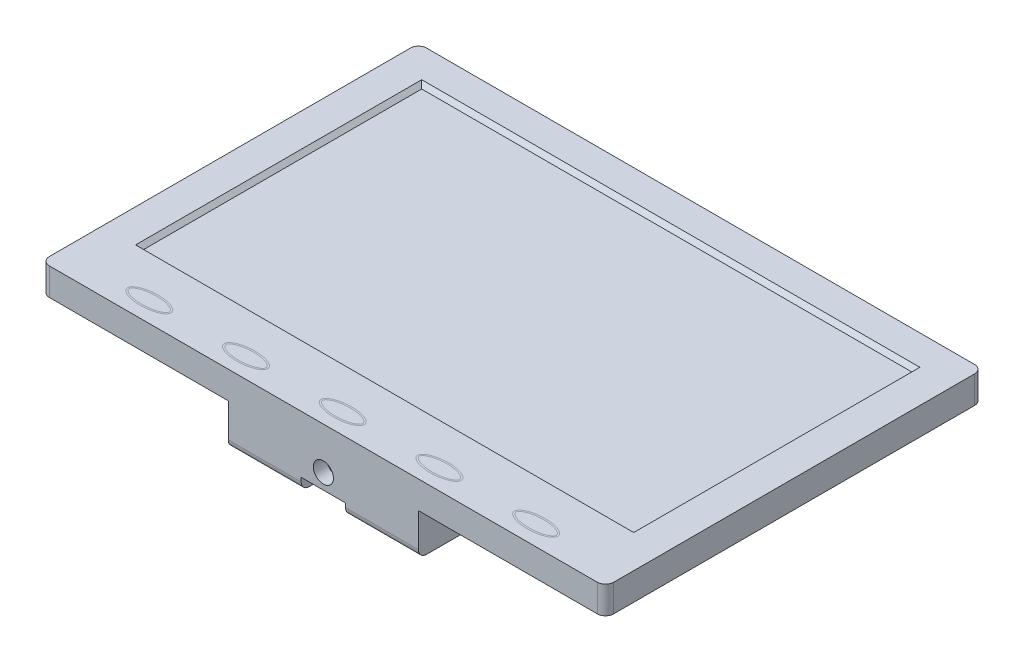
SolidWorks part; units mm, degrees
ref_plane "Front Plane" through (0, 0, 0) normal (0, 0, 1) x (1, 0, 0)
ref_plane "Top Plane" through (0, 0, 0) normal (0, 1, 0) x (1, 0, 0)
ref_plane "Right Plane" through (0, 0, 0) normal (1, 0, 0) x (0, 0, -1)
sketch "Sketch1" plane through (0, 0, 0) normal (0, 1, 0) x (1, 0, 0)
  line L1 (-88.9, 59.436) -> (88.9, 59.436)
  line L2 (-88.9, 59.436) -> (-88.9, -59.436)
  line L3 (-88.9, -59.436) -> (88.9, -59.436)
  line L4 (88.9, 59.436) -> (88.9, -59.436)
  line L5 (-88.9, 59.436) -> (88.9, -59.436) construction
  line L6 (-88.9, -59.436) -> (88.9, 59.436) construction
  point P0 (0, 0)
  dimension "D1" = 118.872
  dimension "D2" = 177.8
extrude "Boss-Extrude1" add sketch "Sketch1" along normal blind 8.636
sketch "Sketch2" plane through (0, 8.636, 0) normal (0, 1, 0) x (1, 0, 0)
  line L0 (-88.9, 59.436) -> (-88.9, -59.436) construction
  line L1 (-77.216, 48.768) -> (77.216, 48.768)
  line L2 (-77.216, 48.768) -> (-77.216, -38.862)
  line L3 (-77.216, -38.862) -> (77.216, -38.862)
  line L4 (77.216, 48.768) -> (77.216, -38.862)
  line L5 (88.9, -59.436) -> (88.9, 59.436) construction
  line L6 (-88.9, -59.436) -> (88.9, -59.436) construction
  line L7 (88.9, 59.436) -> (-88.9, 59.436) construction
  dimension "D1" = 11.684
  dimension "D2" = 11.684
  dimension "D3" = 20.574
  dimension "D4" = 10.668
extrude "Cut-Extrude1" cut sketch "Sketch2" against normal blind 1.27
chamfer "Chamfer1" distance 1.27 angle 45 4 edges at (77.216, 8.636, -4.953) (0, 8.636, 38.862) (-77.216, 8.636, -4.953) (0, 8.636, -48.768)
fillet "Fillet1" radius 2.54 4 edges at (88.9, 4.318, 59.436) (-88.9, 4.318, 59.436) (-88.9, 4.318, -59.436) (88.9, 4.318, -59.436)
sketch "Sketch3" plane through (0, 0, 0) normal (0, -1, 0) x (1, 0, 0)
  line L0 (-29.972, 59.436) -> (-29.972, 49.276)
  line L1 (-86.36, 59.436) -> (86.36, 59.436) construction
  line L2 (-29.972, 49.276) -> (-71.374, 49.276)
  line L3 (-71.374, 49.276) -> (-71.374, -48.26)
  line L4 (-71.374, -48.26) -> (71.374, -48.26)
  line L5 (71.374, -48.26) -> (71.374, 49.276)
  line L6 (71.374, 49.276) -> (29.972, 49.276)
  line L7 (29.972, 49.276) -> (29.972, 59.436)
  line L8 (-29.972, 59.436) -> (29.972, 59.436)
  line L10 (-88.9, -56.896) -> (-88.9, 56.896) construction
  dimension "D1" = 59.944
  dimension "D2" = 97.536
  dimension "D3" = 10.16
  dimension "D4" = 142.748
  dimension "D5" = 58.928
extrude "Boss-Extrude2" add sketch "Sketch3" along normal blind 13.208
sketch "Sketch4" plane through (0, 0, 59.436) normal (0, 0, 1) x (1, 0, 0)
  line L0 (-86.36, 8.636) -> (86.36, 8.636) construction
  line L3 (-29.972, -13.208) -> (-29.972, 0) construction
  circle A0 centre (0, -4.572) radius 3.175
  dimension "D2" = 6.35
  dimension "D1" = 13.208
  dimension "D3" = 29.972
extrude "Cut-Extrude2" cut sketch "Sketch4" against normal blind 4.2672
fillet "Fillet2" radius 2.54 1 edges at (0, -13.208, 59.436)
chamfer "Chamfer2" distance 13.208 angle 30 1 edges at (0, -13.208, -48.26)
chamfer "Chamfer3" distance 13.208 angle 30 2 edges at (71.374, -13.208, 4.3208) (-71.374, -13.208, 4.3208)
chamfer "Chamfer4" distance 13.208 angle 15 2 edges at (46.8602, -13.208, 49.276) (-46.8602, -13.208, 49.276)
fillet "Fillet3" radius 2.54 9 edges at (67.5612, -6.604, 47.5065) (67.5612, -6.604, -44.4472) (-67.5612, -6.604, -44.4472) (63.7484, -13.208, 2.5513) (46.8602, -13.208, 45.7369) (0, -13.208, -40.6344) (-63.7484, -13.208, 2.5513) (-67.5612, -6.604, 47.5065) (-46.8602, -13.208, 45.7369)
sketch "Sketch5" plane through (0, -13.208, 0) normal (0, -1, 0) x (1, 0, 0)
  line L1 (63.5519, 34.4921) -> (88.9519, 34.4921)
  line L2 (63.5519, 34.4921) -> (63.5519, -27.4839)
  line L3 (63.5519, -27.4839) -> (88.9519, -27.4839)
  line L4 (88.9519, 34.4921) -> (88.9519, -27.4839)
  line L5 (-62.2819, -39.1679) -> (62.2819, -39.1679) construction
  line L7 (-63.5519, 34.4921) -> (-88.9519, 34.4921)
  line L8 (-63.5519, 34.4921) -> (-63.5519, -27.4839)
  line L9 (-63.5519, -27.4839) -> (-88.9519, -27.4839)
  line L10 (-88.9519, 34.4921) -> (-88.9519, -27.4839)
  line L11 (62.2819, -39.1679) -> (62.2819, 43.7879) construction
  line L12 (-62.2819, 43.7879) -> (-62.2819, -39.1679) construction
  dimension "D1" = 61.976
  dimension "D2" = 11.684
  dimension "D3" = 25.4
  dimension "D4" = 25.4
  dimension "D5" = 1.27
  dimension "D6" = 1.27
extrude "Cut-Extrude3" cut sketch "Sketch5" against normal up to surface (13.208 mm away)
ref_plane "Plane1" through (0, -8.89, 0) normal (0, 1, 0) x (1, 0, 0)
sketch "Sketch14" plane through (0, -8.89, 0) normal (0, 1, 0) x (1, 0, 0)
  line L0 (-63.5519, 8.4339) -> (-49.5819, 8.4339)
  line L1 (-63.5519, 27.4839) -> (-63.5519, -34.4921) construction
  line L2 (-63.5519, 8.4339) -> (-63.5519, 14.7839)
  line L3 (-63.5519, 14.7839) -> (-49.5819, 14.7839)
  line L4 (-49.5819, 8.4339) -> (-43.2319, 8.4339)
  line L6 (-71.374, 27.4839) -> (-64.4816, 27.4839) construction
  arc A0 (-43.2319, 8.4339) -> (-49.5819, 14.7839) centre (-49.5819, 8.4339) ccw
  dimension "D2" = 13.97
  dimension "D3" = 19.05
  dimension "D1" = 6.35
revolve "Revolve4" add sketch "Sketch14" angle 360 about L0
sketch "Sketch15" plane through (63.5519, 0, 0) normal (1, 0, 0) x (0, 0, -1)
  line L2 (39.1679, -13.208) -> (-43.7879, -13.208) construction
  line L3 (-34.4921, 0) -> (27.4839, 0) construction
  line L4 (27.4839, 0) -> (27.4839, -12.8677) construction
  circle A0 centre (18.5939, -6.604) radius 3.175
  dimension "D1" = 6.35
  dimension "D2" = 6.604
  dimension "D3" = 6.604
  dimension "D4" = 8.89
extrude "Cut-Extrude4" cut sketch "Sketch15" against normal blind 8.89
sketch "Sketch16" plane through (54.6619, 0, 0) normal (1, 0, 0) x (0, 0, -1)
  circle A0 centre (18.5939, -6.604) radius 2.921
  circle A1 centre (18.5939, -6.604) radius 1.778
  dimension "D2" = 5.842
  dimension "D1" = 3.556
extrude "Boss-Extrude4" add sketch "Sketch16" along normal blind 8.89
fillet "Fillet4" radius 0.254 2 edges at (63.5519, -6.604, -21.5149) (63.5519, -6.604, -20.3719)
sketch "Sketch17" plane through (0, -13.208, 0) normal (0, -1, 0) x (-1, 0, 0)
  line L0 (41.5809, 17.5779) -> (41.5809, 32.8179) construction
  line L1 (41.1999, 17.5779) -> (41.1999, 32.8179)
  line L2 (41.9619, 17.5779) -> (41.9619, 32.8179)
  line L3 (62.2819, 39.1679) -> (-62.2819, 39.1679) construction
  line L4 (62.2819, 13.0898) -> (62.2819, 39.1679) construction
  arc A0 (41.1999, 17.5779) -> (41.9619, 17.5779) centre (41.5809, 17.5779) ccw
  arc A1 (41.9619, 32.8179) -> (41.1999, 32.8179) centre (41.5809, 32.8179) ccw
  point P2 (41.5809, 25.1979)
  dimension "D1" = 0.762
  dimension "D2" = 15.24
  dimension "D3" = 13.97
  dimension "D4" = 20.32
extrude "Cut-Extrude5" cut sketch "Sketch17" against normal blind 12.7
pattern_linear "LPattern1" count 30 spacing 3.175 along (1, 0, 0) of "Cut-Extrude5"
sketch "Sketch18" plane through (-63.5519, 0, 0) normal (-1, 0, 0) x (0, 0, 1)
  line L1 (-3.4841, -12.8677) -> (34.4921, -12.8677) construction
  line L2 (34.4921, 0) -> (34.4921, -12.8677) construction
  circle A0 centre (24.3321, -7.5337) radius 2.794
  dimension "D1" = 5.588
  dimension "D2" = 5.334
  dimension "D3" = 10.16
extrude "Cut-Extrude6" cut sketch "Sketch18" against normal blind 12.7
sketch "Sketch19" plane through (-50.8519, 0, 0) normal (-1, 0, 0) x (0, 0, 1)
  circle A0 centre (24.3321, -7.5337) radius 0.762
  dimension "D1" = 1.524
extrude "Boss-Extrude5" add sketch "Sketch19" along normal blind 8.89
fillet "Fillet5" radius 0.762 1 edges at (-59.7419, -7.5337, 25.0941)
sketch "Sketch20" plane through (-50.8519, 0, 0) normal (-1, 0, 0) x (0, 0, 1)
  circle A0 centre (24.3321, -7.5337) radius 1.016
  dimension "D1" = 2.032
extrude "Boss-Extrude6" add sketch "Sketch20" along normal blind 1.27
sketch "Sketch22" plane through (-63.5519, 0, 0) normal (-1, 0, 0) x (0, 0, 1)
  line L0 (-3.4841, -12.8677) -> (34.4921, -12.8677) construction
  line L1 (-1.0679, -4.9937) -> (11.6321, -4.9937)
  line L2 (-1.0679, -4.9937) -> (-1.0679, -10.0737)
  line L3 (-1.0679, -10.0737) -> (11.6321, -10.0737)
  line L4 (11.6321, -4.9937) -> (11.6321, -10.0737)
  line L5 (-1.0679, -4.9937) -> (11.6321, -10.0737) construction
  line L6 (-1.0679, -10.0737) -> (11.6321, -4.9937) construction
  circle A0 centre (24.3321, -7.5337) radius 2.794 construction
  point P0 (5.2821, -7.5337)
  dimension "D1" = 12.7
  dimension "D2" = 5.08
  dimension "D3" = 5.334
  dimension "D4" = 12.7
extrude "Cut-Extrude7" cut sketch "Sketch22" against normal blind 12.7
sketch "Sketch24" plane through (-50.8519, 0, 0) normal (-1, 0, 0) x (0, 0, 1)
  line L1 (-0.4329, -7.9147) -> (10.9971, -7.9147)
  line L2 (-0.4329, -7.9147) -> (-0.4329, -9.1847)
  line L3 (-0.4329, -9.1847) -> (10.9971, -9.1847)
  line L4 (10.9971, -7.9147) -> (10.9971, -9.1847)
  line L5 (-0.4329, -7.9147) -> (10.9971, -9.1847) construction
  line L6 (-0.4329, -9.1847) -> (10.9971, -7.9147) construction
  line L7 (-1.0679, -4.9937) -> (-1.0679, -10.0737) construction
  line L8 (-1.0679, -10.0737) -> (11.6321, -10.0737) construction
  point P0 (5.2821, -8.5497)
  dimension "D1" = 1.524
  dimension "D2" = 1.27
  dimension "D3" = 11.43
  dimension "D4" = 6.35
extrude "Boss-Extrude7" add sketch "Sketch24" along normal blind 11.43
chamfer "Chamfer5" distance 0.508 angle 30 4 edges at (-62.2819, -9.1847, 5.2821) (-62.2819, -8.5497, -0.4329) (-62.2819, -7.9147, 5.2821) (-62.2819, -8.5497, 10.9971)
sketch "Sketch25" plane through (63.5519, 0, 0) normal (1, 0, 0) x (0, 0, -1)
  line L0 (-7.4411, -9.8197) -> (7.7989, -9.8197)
  line L1 (7.7989, -9.8197) -> (7.7989, -6.0097)
  line L2 (7.7989, -6.0097) -> (4.7193, -4.2317)
  line L3 (4.7193, -4.2317) -> (-4.3615, -4.2317)
  line L4 (-4.3615, -4.2317) -> (-7.4411, -6.0097)
  line L5 (-7.4411, -6.0097) -> (-7.4411, -9.8197)
  line L6 (-34.4921, -12.8677) -> (27.4839, -12.8677) construction
  circle A0 centre (18.5939, -6.604) radius 3.175 construction
  point P10 (0.1789, -4.2317)
  point P11 (0.1789, -9.8197)
  dimension "D1" = 15.24
  dimension "D2" = 10.795
  dimension "D3" = 3.048
  dimension "D4" = 3.81
  dimension "D5" = 210
  dimension "D6" = 5.588
  dimension "D7" = 210
extrude "Cut-Extrude8" cut sketch "Sketch25" against normal blind 12.7
fillet "Fillet6" radius 0.508 2 edges at (57.2019, -9.8197, -7.7989) (57.2019, -9.8197, 7.4411)
sketch "Sketch26" plane through (63.5519, 0, 0) normal (1, 0, 0) x (0, 0, -1)
  line L0 (-21.6651, -7.0257) -> (-14.0451, -7.0257)
  line L1 (-14.0451, -7.0257) -> (-14.0451, -5.2477)
  line L2 (-14.0451, -5.2477) -> (-14.5531, -4.6689)
  line L3 (-14.5531, -4.6689) -> (-14.5531, -3.9777)
  line L4 (-14.5531, -3.9777) -> (-21.1571, -3.9777)
  line L5 (-21.1571, -3.9777) -> (-21.1571, -4.6689)
  line L6 (-21.1571, -4.6689) -> (-21.6651, -5.2477)
  line L7 (-21.6651, -5.2477) -> (-21.6651, -7.0257)
  line L8 (-34.4921, -12.8677) -> (27.4839, -12.8677) construction
  line L9 (-7.4411, -6.0097) -> (-7.4411, -9.3117) construction
  point P0 (-17.8551, -3.9777)
  point P11 (-17.8551, -7.0257)
  dimension "D1" = 7.62
  dimension "D2" = 5.842
  dimension "D3" = 3.048
  dimension "D4" = 1.778
  dimension "D5" = 6.604
  dimension "D6" = 6.604
extrude "Cut-Extrude9" cut sketch "Sketch26" against normal blind 6.35
fillet "Fillet7" radius 0.254 4 edges at (60.3769, -3.9777, 14.5531) (60.3769, -3.9777, 21.1571) (60.3769, -7.0257, 14.0451) (60.3769, -7.0257, 21.6651)
sketch "Sketch27" plane through (0, 8.636, 0) normal (0, 1, 0) x (1, 0, 0)
  line L0 (-86.36, -59.436) -> (86.36, -59.436) construction
  line L1 (-88.9, 56.896) -> (-88.9, -56.896) construction
  line L2 (-66.8111, -54.102) -> (-55.6169, -54.102) construction
  line L3 (-36.3311, -54.102) -> (-25.1369, -54.102) construction
  line L4 (-5.8511, -54.102) -> (5.3431, -54.102) construction
  line L5 (24.6289, -54.102) -> (35.8231, -54.102) construction
  line L6 (55.1089, -54.102) -> (66.3031, -54.102) construction
  ellipse E0 centre (-61.214, -53.086) end of major axis (-54.356, -53.086) minor radius 2.794
  ellipse E1 centre (-30.734, -53.086) end of major axis (-37.592, -53.086) minor radius 2.794
  ellipse E2 centre (-0.254, -53.086) end of major axis (6.604, -53.086) minor radius 2.794
  ellipse E3 centre (30.226, -53.086) end of major axis (37.084, -53.086) minor radius 2.794
  ellipse E4 centre (60.706, -53.086) end of major axis (67.564, -53.086) minor radius 2.794
  point P10 (-54.864, -53.086)
  point P20 (-24.3838, -53.0866)
  point P29 (6.096, -53.086)
  point P38 (36.576, -53.086)
  point P49 (67.056, -53.086)
  dimension "D1" = 5.588
  dimension "D2" = 13.716
  dimension "D3" = 3.556
  dimension "D4" = 20.828
  dimension "D6" = 1.778
  dimension "D7" = 5
  dimension "D8" = 1.778
  dimension "D10" = 1.778
  dimension "D5" = 0.508
wrap "Wrap3" sketch "Sketch27" wrap type scribe source sketch "Sketch27"
sketch "Sketch28" plane through (0, -13.208, 0) normal (0, -1, 0) x (1, 0, 0)
  line L0 (-3.81, 16.764) -> (3.81, 16.764)
  line L1 (3.81, 16.764) -> (3.81, 48.768)
  line L2 (3.81, 48.768) -> (6.985, 51.816)
  line L3 (6.985, 51.816) -> (6.985, 59.436)
  line L4 (-29.972, 59.436) -> (29.972, 59.436) construction
  line L5 (6.985, 59.436) -> (-6.985, 59.436)
  line L6 (-6.985, 59.436) -> (-6.985, 51.816)
  line L7 (-3.81, 16.764) -> (-3.81, 48.768)
  line L8 (-3.81, 48.768) -> (-6.985, 51.816)
  point P7 (0, 16.764)
  point P11 (0, 59.436)
  point P13 (-3.81, 31.2223)
  dimension "D1" = 13.97
  dimension "D2" = 7.62
  dimension "D3" = 32.004
  dimension "D4" = 3.048
  dimension "D5" = 7.62
extrude "Cut-Extrude10" cut sketch "Sketch28" against normal blind 3.81
fillet "Fillet8" radius 1.016 6 edges at (-6.985, -11.303, 51.816) (-3.81, -11.303, 48.768) (-3.81, -11.303, 16.764) (3.81, -11.303, 16.764) (3.81, -11.303, 48.768) (6.985, -11.303, 51.816)
